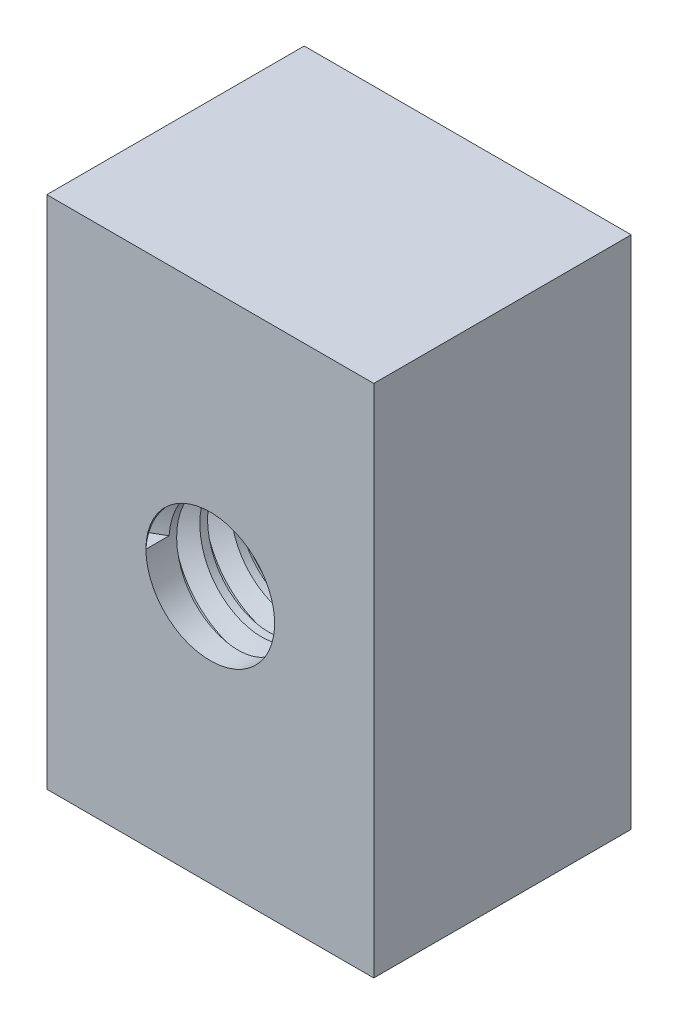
SolidWorks part; units mm, degrees
ref_plane "Front Plane" through (0, 0, 0) normal (0, 0, 1) x (1, 0, 0)
ref_plane "Top Plane" through (0, 0, 0) normal (0, 1, 0) x (1, 0, 0)
ref_plane "Right Plane" through (0, 0, 0) normal (1, 0, 0) x (0, 0, -1)
sketch "Sketch1" plane through (0, 0, 0) normal (0, 0, 1) x (1, 0, 0)
  line L1 (3.175, -5) -> (-3.175, -5)
  line L2 (3.175, -5) -> (3.175, 5)
  line L3 (3.175, 5) -> (-3.175, 5)
  line L4 (-3.175, -5) -> (-3.175, 5)
  line L5 (3.175, -5) -> (-3.175, 5) construction
  line L6 (3.175, 5) -> (-3.175, -5) construction
  point P0 (0, 0)
  dimension "D1" = 6.35
  dimension "D2" = 10
extrude "Boss-Extrude1" add sketch "Sketch1" along normal blind 5
sketch "Sketch2" plane through (0, 0, 5) normal (0, 0, 1) x (1, 0, 0)
  point P0 (0, 0)
sketch "Sketch3" plane through (0, 0, 5) normal (0, 0, 1) x (1, 0, 0)
  circle A0 centre (0, 0) radius 1.25
  dimension "D1" = 2.5
extrude "Cut-Extrude1" cut sketch "Sketch3" against normal through all
thread "Thread1" pitch 0.6 start angle 0, offset 0, length 6, pitch 0.6, diameter 2.5
ref_plane "Plane1" through (-1.25, 0, 5) normal (0, -1, 0) x (-1, 0, 0)
sketch "Thread Profile1" plane through (-1.25, 0, 5) normal (0, -1, 0) x (-1, 0, 0)
  line L0 (0, 0) -> (0, 0.6) construction
  line L1 (0, 0) -> (0.3248, 0.1875)
  line L2 (0.3248, 0.1875) -> (0.3248, 0.2625)
  line L3 (0.3248, 0.2625) -> (0, 0.45)
  line L4 (0.3248, 0.225) -> (0, 0.225) construction
  line L11 (0, 0) -> (0, 0.45)
  point P2 (0, 0)
  dimension "Pitch" = 0.6
  dimension "Profile_Angle" = 60
  dimension "Profile_Land" = 0.075
  dimension "Profile_Height" = 0.3248
